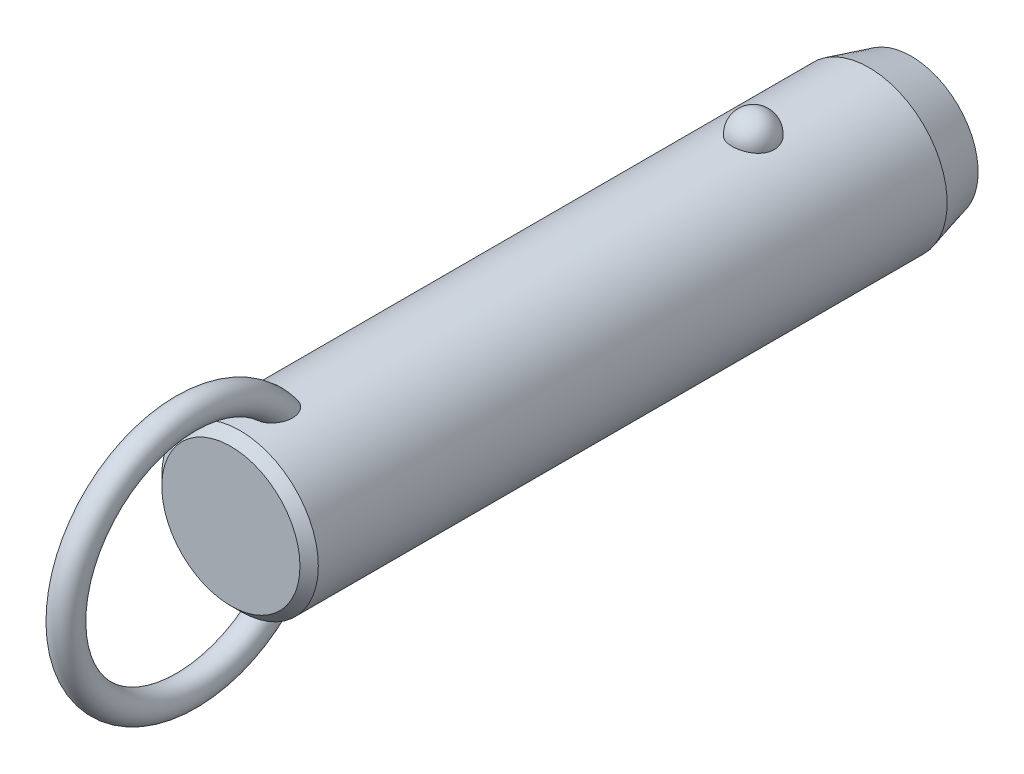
SolidWorks part; units mm, degrees
ref_plane "Front Plane" through (0, 0, 0) normal (0, 0, 1) x (1, 0, 0)
ref_plane "Top Plane" through (0, 0, 0) normal (0, 1, 0) x (1, 0, 0)
ref_plane "Right Plane" through (0, 0, 0) normal (1, 0, 0) x (0, 0, -1)
sketch "Sketch2" plane through (0, 0, 0) normal (0, 0, 1) x (1, 0, 0)
  circle A0 centre (0, 0) radius 11.1
  point P3 (0, 11.1)
  dimension "D1" = 22.2
extrude "Boss-Extrude1" add sketch "Sketch2" along normal blind 58.4
sketch "Sketch3" plane through (0, 0, 0) normal (0, 0, -1) x (-1, 0, 0)
  circle A0 centre (0, 0) radius 11.1
  dimension "D1" = 22.2
extrude "Boss-Extrude2" add sketch "Sketch3" along normal blind 25.4
chamfer "Chamfer1" distance 6 angle 15 1 edges at (-11.1, 0, -25.4)
sketch "Sketch12" plane through (0, 0, 0) normal (1, 0, 0) x (0, 0, -1)
  line L0 (-58.4, 11.1) -> (-58.4, -11.1) construction
  point P0 (-58.4, 0)
sketch "Sketch13" plane through (0, 0, 0) normal (1, 0, 0) x (0, 0, -1)
  circle A0 centre (-77.45, 0) radius 19.05
  point P2 (-58.4, 0)
  dimension "D1" = 38.1
sketch "Sketch14" plane through (0, 0, 0) normal (0, 1, 0) x (1, 0, 0)
  circle A0 centre (0, -60.4) radius 2
  point P2 (0, -58.4)
  dimension "D1" = 4
sweep "Sweep1" add profiles "Sketch14" path "Sketch13"
sketch "Sketch15" plane through (0, 0, 58.4) normal (0, 0, 1) x (1, 0, 0)
  circle A0 centre (0, 0) radius 11.1
  dimension "D1" = 22.2
extrude "Boss-Extrude3" add sketch "Sketch15" along normal blind 12.7
chamfer "Chamfer2" distance 1.3 angle 45 1 edges at (11.1, 0, 71.1)
sketch "Sketch18" plane through (0, 0, 0) normal (1, 0, 0) x (0, 0, -1)
  line L0 (19.4, 11.1) -> (-61.968, 11.1) construction
  line L1 (3, 14.1) -> (3, 8.1)
  line L2 (-61.968, -11.1) -> (19.4, -11.1) construction
  arc A0 (3, 14.1) -> (3, 8.1) centre (3, 11.1) ccw
  point P4 (0, 11.1)
  dimension "D1" = 25.2
revolve "Revolve1" add sketch "Sketch18" angle 360 about L1
